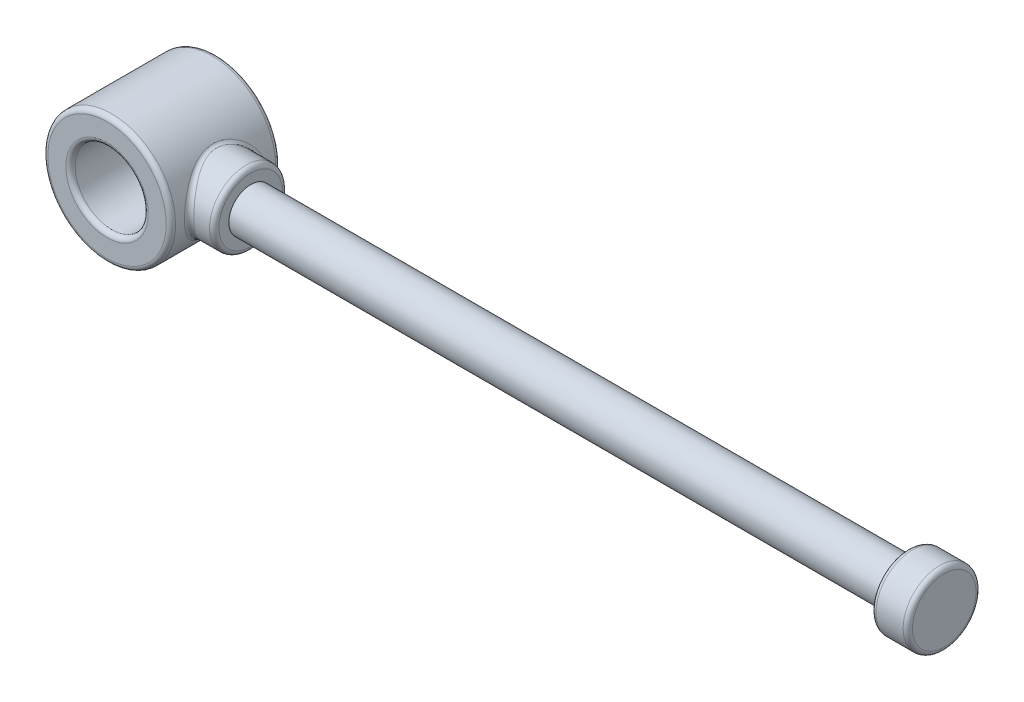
SolidWorks part; units mm, degrees
ref_plane "Front Plane" through (0, 0, 0) normal (0, 0, 1) x (1, 0, 0)
ref_plane "Top Plane" through (0, 0, 0) normal (0, 1, 0) x (1, 0, 0)
ref_plane "Right Plane" through (0, 0, 0) normal (1, 0, 0) x (0, 0, -1)
sketch "Sketch1" plane through (0, 0, 0) normal (0, 0, 1) x (1, 0, 0)
  line L0 (-127, 0) -> (0, 0)
  line L1 (0, 0) -> (0, 6.35)
  line L2 (0, 6.35) -> (-6.35, 6.35)
  line L3 (-127, 6.35) -> (-127, 0)
  line L4 (-120.65, 6.35) -> (-120.65, 3.81)
  line L5 (-120.65, 3.81) -> (-6.35, 3.81)
  line L6 (-6.35, 3.81) -> (-6.35, 6.35)
  line L7 (-120.65, 6.35) -> (-127, 6.35)
  circle A0 centre (-136.1195, 0) radius 11.1125 construction
  circle A1 centre (-136.1195, 0) radius 6.35 construction
  dimension "D1" = 12.7
  dimension "D2" = 22.225
  dimension "D3" = 6.35
  dimension "D4" = 127
  dimension "D5" = 6.35
  dimension "D6" = 6.35
  dimension "D7" = 3.81
revolve "Revolve1" add sketch "Sketch1" angle 360 about L0
sketch "Sketch2" plane through (0, 0, 0) normal (0, 0, 1) x (1, 0, 0)
  circle A0 centre (-136.1195, 0) radius 11.1125 construction
  circle A1 centre (-136.1195, 0) radius 6.35 construction
  circle A2 centre (-136.1195, 0) radius 11.1125
  circle A3 centre (-136.1195, 0) radius 6.35
extrude "Boss-Extrude1" add sketch "Sketch2" along normal mid plane 19.05
fillet "Fillet1" radius 0.8128 8 edges at (-129.7695, 0, -9.525) (-125.007, 0, -9.525) (-125.007, 0, 9.525) (-129.7695, 0, 9.525) (0, 0, 6.35) (-6.35, 0, 6.35) (-120.65, 0, 6.35) (-125.1659, -1.8728, -6.0675)
